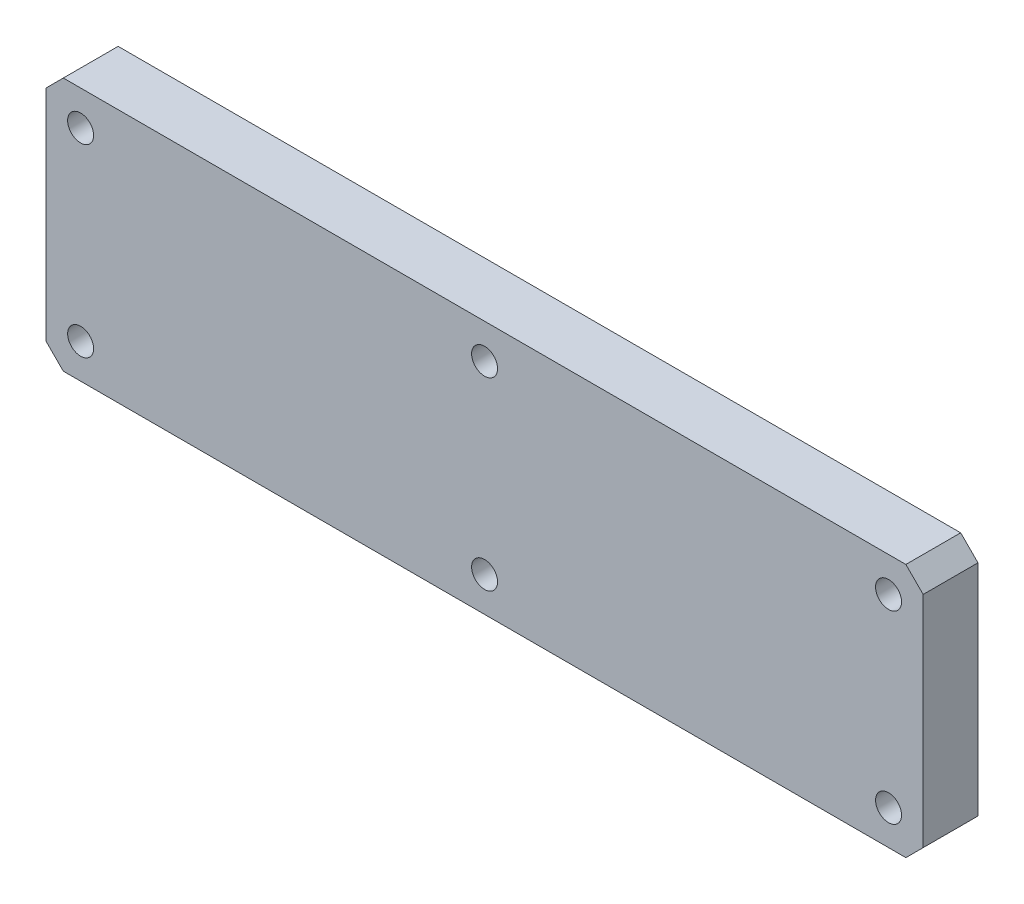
SolidWorks part; units mm, degrees
ref_plane "Спереди" through (0, 0, 0) normal (0, 0, 1) x (1, 0, 0)
ref_plane "Сверху" through (0, 0, 0) normal (0, 1, 0) x (1, 0, 0)
ref_plane "Справа" through (0, 0, 0) normal (1, 0, 0) x (0, 0, -1)
sketch "Эскиз1" plane through (0, 0, 0) normal (0, 0, 1) x (1, 0, 0)
  line L1 (0, 0) -> (152, 0)
  line L2 (0, 0) -> (0, 44)
  line L3 (0, 44) -> (152, 44)
  line L4 (152, 0) -> (152, 44)
  dimension "D1" = 44
  dimension "D2" = 152
extrude "Бобышка-Вытянуть1" add sketch "Эскиз1" along normal blind 9.5
sketch "Эскиз2" plane through (0, 0, 0) normal (0, 0, -1) x (-1, 0, 0)
  line L0 (-76, 55.4684) -> (-76, -16.955) construction
  line L1 (-152, 44) -> (0, 44) construction
  line L2 (-152, 22) -> (4.8885, 22) construction
  line L3 (-152, 0) -> (-152, 44) construction
  circle A0 centre (-146, 38) radius 2.25
  point P6 (-76, 44)
  dimension "D1" = 4.5
  dimension "D3" = 16
  dimension "D2" = 70
extrude "Вырез-Вытянуть1" cut sketch "Эскиз2" against normal through all
chamfer "Фаска1" distance 2.05 1 edges at (143.75, 38, 0)
pattern_linear "Линейный массив1" count 3 spacing 70 along (-1, 0, 0) count 2 spacing 32 along (0, -1, 0) of "Вырез-Вытянуть1", "Фаска1"
chamfer "Фаска2" distance 3 angle 45 4 edges at (152, 44, 4.75) (0, 44, 4.75) (0, 0, 4.75) (152, 0, 4.75)
